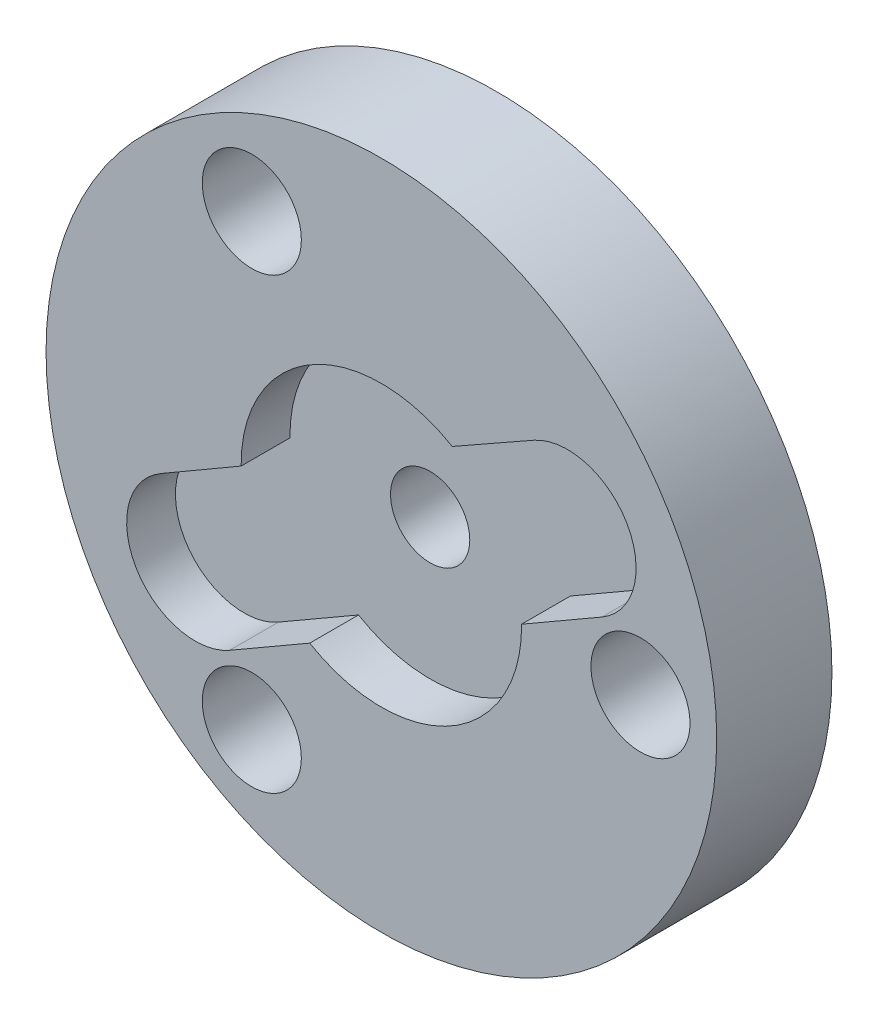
SolidWorks part; units mm, degrees
ref_plane "Piano frontale" through (0, 0, 0) normal (0, 0, 1) x (1, 0, 0)
ref_plane "Piano superiore" through (0, 0, 0) normal (0, 1, 0) x (1, 0, 0)
ref_plane "Piano destro" through (0, 0, 0) normal (1, 0, 0) x (0, 0, -1)
sketch "Schizzo1" plane through (0, 0, 0) normal (0, 0, 1) x (1, 0, 0)
  circle A0 centre (0, 0) radius 11
  dimension "D1" = 22
extrude "Estrusione-Estrusione1" add sketch "Schizzo1" along normal blind 3.7811
sketch "Schizzo2" plane through (0, 0, 3.7811) normal (0, 0, 1) x (1, 0, 0)
  line L0 (8.5, 0) -> (0, 0)
  line L1 (0, 0) -> (-6.4084, 11.0997)
  line L2 (0, 0) -> (-6.3522, -11.0024)
  circle A0 centre (8.5, 0) radius 1.625
  circle A1 centre (-4.25, 7.3612) radius 1.625
  circle A2 centre (-4.25, -7.3612) radius 1.625
  circle A3 centre (0, 0) radius 1.3
  dimension "D1" = 3.25
  dimension "D9" = 2.6
  dimension "D2" = 8.5
  dimension "D3" = 120
  dimension "D4" = 120
  dimension "D6" = 8.5
  dimension "D8" = 8.5
extrude "Taglio-Estrusione1" cut sketch "Schizzo2" against normal through all
sketch "Schizzo3" plane through (0, 0, 3.7811) normal (0, 0, 1) x (1, 0, 0)
  line L0 (-1.133, 1.9625) -> (-4.25, 7.3612)
  line L1 (8.054, 4.65) -> (11.4619, 6.6175)
  line L3 (4.9966, 5.4828) -> (2.3247, 3.9694)
  line L4 (2.3247, 3.9694) -> (-7.2349, -1.579)
  line L5 (-4.976, -5.471) -> (7.2305, 1.5764)
  line L6 (-8.054, -4.65) -> (-11.1095, -6.4141)
  arc A0 (2.3247, 3.9694) -> (-4.5997, -0.0496) centre (0, 0) ccw
  arc A1 (7.2305, 1.5764) -> (4.9966, 5.4828) centre (6.1055, 3.525) ccw
  arc A3 (-7.2349, -1.579) -> (-4.976, -5.471) centre (-6.1055, -3.525) ccw
  arc A4 (-2.3496, -3.9546) -> (4.5996, 0.0575) centre (0, 0) ccw
  dimension "D1" = 9.2
  dimension "D2" = 4.5
  dimension "D4" = 4.5
  dimension "D3" = 7.05
  dimension "D5" = 7.05
extrude "Taglio-Estrusione2" cut sketch "Schizzo3" against normal blind 1.6 contours L4 A3 L5 A1 L3 M5 | L4 A0 L0 | L0 A0 L4 | L5 A4
